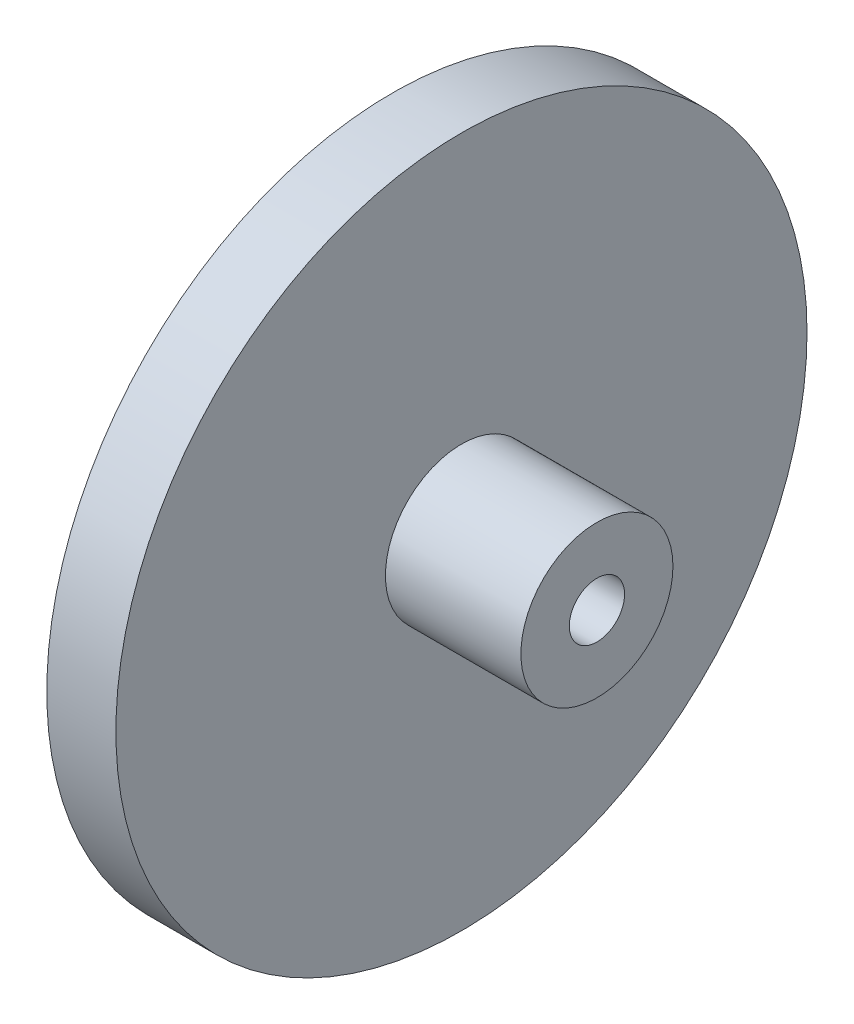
SolidWorks part; units mm, degrees
ref_plane "Plan1" through (0, 0, 0) normal (0, 0, 1) x (1, 0, 0)
ref_plane "Plan2" through (0, 0, 0) normal (0, 1, 0) x (1, 0, 0)
ref_plane "Plan3" through (0, 0, 0) normal (1, 0, 0) x (0, 0, -1)
sketch "Esquisse1" plane through (0, 0, 0) normal (0, 0, 1) x (1, 0, 0)
  line L0 (9.859, 0) -> (-26.0254, 0) construction
  line L1 (0, 0) -> (0, 5.861) construction
  line L2 (-7.4, 12.5) -> (-4.9, 12.5)
  line L3 (-4.9, 12.5) -> (-4.9, 2.75)
  line L4 (0, 1) -> (-7.4, 1)
  line L5 (-7.4, 1) -> (-7.4, 2.95)
  line L6 (-7.4, 2.95) -> (-6.4, 2.95)
  line L7 (-6.4, 2.95) -> (-6.4, 9.68)
  line L8 (-6.4, 9.68) -> (-7.4, 9.925)
  line L9 (-7.4, 9.925) -> (-7.4, 12.5)
  line L10 (-4.9, 2.75) -> (0, 2.75)
  line L11 (0, 2.75) -> (0, 1)
  dimension "D1" = 7.4
  dimension "D2" = 1
  dimension "D3" = 2.95
  dimension "D4" = 1
  dimension "D5" = 9.68
  dimension "D6" = 9.925
  dimension "D7" = 1
  dimension "D8" = 12.5
  dimension "D9" = 2.5
  dimension "D10" = 2.75
revolve "Base-Révolution" add sketch "Esquisse1" angle 360 about L0
